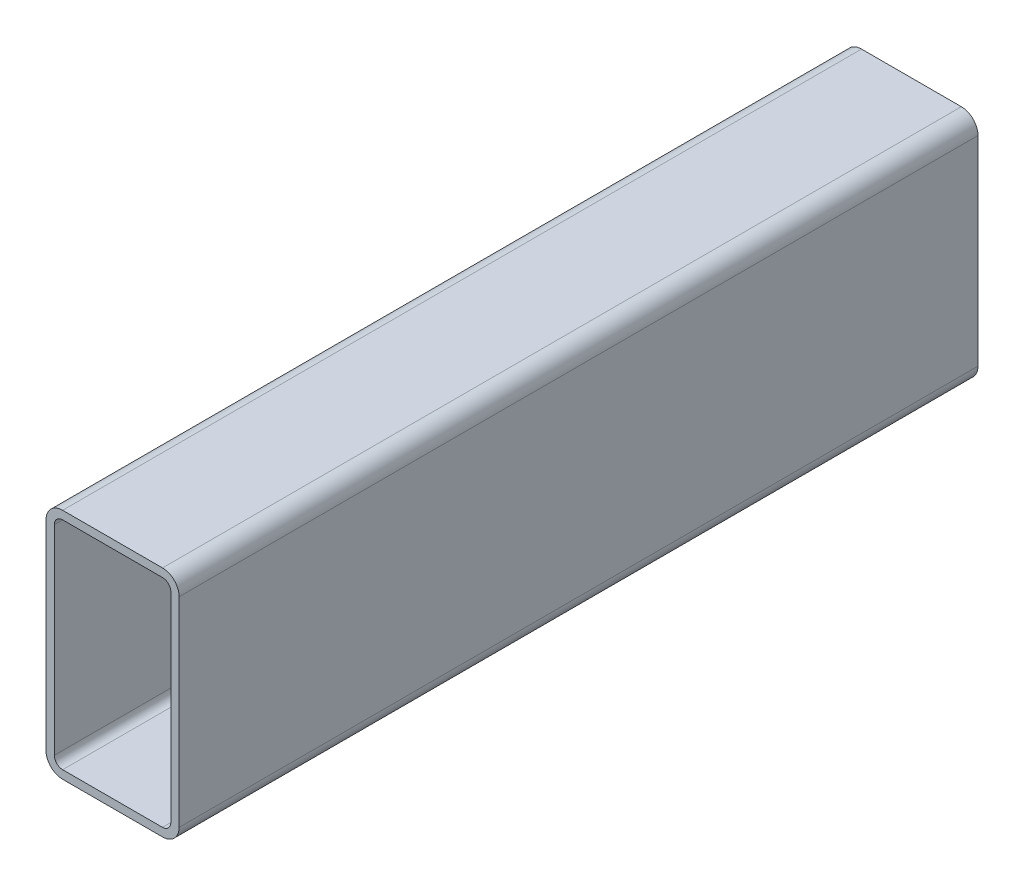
SolidWorks part; units mm, degrees
ref_plane "Front Plane" through (0, 0, 0) normal (0, 0, 1) x (1, 0, 0)
ref_plane "Top Plane" through (0, 0, 0) normal (0, 1, 0) x (1, 0, 0)
ref_plane "Right Plane" through (0, 0, 0) normal (1, 0, 0) x (0, 0, -1)
sketch "Sketch1" plane through (0, 0, 0) normal (0, 0, 1) x (1, 0, 0)
  line B0 (6.35, 88.9) -> (44.45, 88.9)
  arc B1 (50.8, 82.55) -> (44.45, 88.9) centre (44.45, 82.55) ccw
  line B2 (50.8, 82.55) -> (50.8, 6.35)
  arc B3 (44.45, 0) -> (50.8, 6.35) centre (44.45, 6.35) ccw
  line B4 (44.45, 0) -> (6.35, 0)
  arc B5 (0, 6.35) -> (6.35, 0) centre (6.35, 6.35) ccw
  line B6 (0, 6.35) -> (0, 82.55)
  arc B7 (6.35, 88.9) -> (0, 82.55) centre (6.35, 82.55) ccw
  line B8 (6.35, 85.725) -> (44.45, 85.725)
  arc B9 (47.625, 82.55) -> (44.45, 85.725) centre (44.45, 82.55) ccw
  line B10 (47.625, 82.55) -> (47.625, 6.35)
  arc B11 (44.45, 3.175) -> (47.625, 6.35) centre (44.45, 6.35) ccw
  line B12 (44.45, 3.175) -> (6.35, 3.175)
  arc B13 (3.175, 6.35) -> (6.35, 3.175) centre (6.35, 6.35) ccw
  line B14 (3.175, 6.35) -> (3.175, 82.55)
  arc B15 (6.35, 85.725) -> (3.175, 82.55) centre (6.35, 82.55) ccw
sketch_block_instance "HSS3.5x2x0.125-1"
sketch_block "HSS3.5x2x0.125"
extrude "Boss-Extrude1" add sketch "Sketch1" along normal blind 304.8
